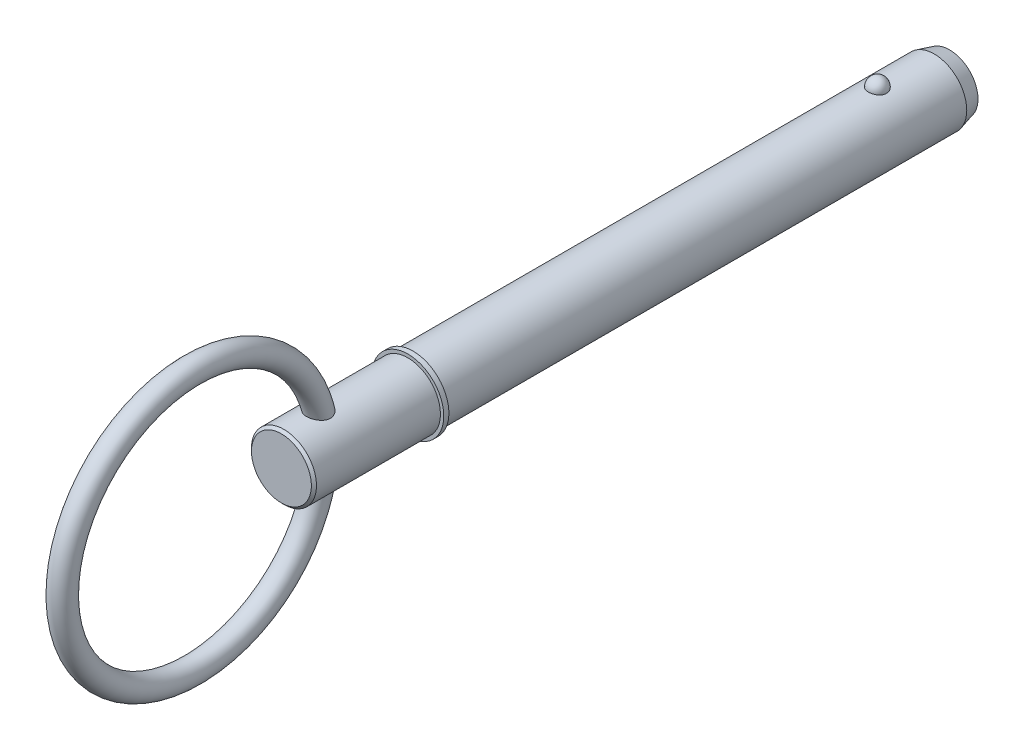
SolidWorks part; units mm, degrees
ref_plane "Front Plane" through (0, 0, 0) normal (0, 0, 1) x (1, 0, 0)
ref_plane "Top Plane" through (0, 0, 0) normal (0, 1, 0) x (1, 0, 0)
ref_plane "Right Plane" through (0, 0, 0) normal (1, 0, 0) x (0, 0, -1)
sketch "Sketch2" plane through (0, 0, 0) normal (0, 0, 1) x (1, 0, 0)
  circle A0 centre (0, 0) radius 6.35
  point P3 (0, 6.35)
  dimension "D1" = 12.7
extrude "Boss-Extrude1" add sketch "Sketch2" along normal blind 88.9
sketch "Sketch3" plane through (0, 0, 0) normal (0, 0, -1) x (-1, 0, 0)
  circle A0 centre (0, 0) radius 6.35
  dimension "D1" = 12.7
extrude "Boss-Extrude2" add sketch "Sketch3" along normal blind 15.88
chamfer "Chamfer1" distance 3 angle 15 1 edges at (-6.35, 0, -15.88)
sketch "Sketch18" plane through (0, 0, 0) normal (1, 0, 0) x (0, 0, -1)
  line L0 (12.88, 6.35) -> (-88.9, 6.35) construction
  line L1 (1.78, 8.13) -> (1.78, 4.57)
  line L2 (-88.9, -6.35) -> (12.88, -6.35) construction
  arc A0 (1.78, 8.13) -> (1.78, 4.57) centre (1.78, 6.35) ccw
  point P4 (0, 6.35)
  dimension "D1" = 14.48
revolve "Revolve1" add sketch "Sketch18" angle 360 about L1
sketch "Sketch19" plane through (0, 0, 0) normal (1, 0, 0) x (0, 0, -1)
  line L0 (-33.7288, 0) -> (-46.4542, 0) construction
sketch "Sketch20" plane through (0, 0, 0) normal (1, 0, 0) x (0, 0, -1)
  line L0 (-88.9, 0) -> (-88.9, 7)
  line L1 (-88.9, 6.35) -> (-88.9, -6.35) construction
  line L2 (-88.9, 7) -> (-89.9, 7)
  line L3 (-89.9, 7) -> (-89.9, 0)
  line L4 (-33.7288, 0) -> (-46.4542, 0) construction
  line L5 (-89.9, 0) -> (-88.9, 0)
  dimension "D1" = 7
  dimension "D2" = 1
revolve "Revolve2" add sketch "Sketch20" angle 360 about L0
sketch "Sketch21" plane through (0, 0, 88.9) normal (0, 0, -1) x (-1, 0, 0)
  circle A0 centre (0, 0) radius 6.35
  dimension "D1" = 12.7
extrude "Boss-Extrude3" add sketch "Sketch21" against normal blind 25.7
chamfer "Chamfer2" distance 0.5 angle 45 1 edges at (-6.35, 0, 114.6)
sketch "Sketch23" plane through (0, 0, 0) normal (1, 0, 0) x (0, 0, -1)
  line L0 (-114.6, 5.85) -> (-114.6, -5.85) construction
  circle A0 centre (-132, 0) radius 25.4
  point P2 (-106.6, 0)
  dimension "D1" = 50.8
  dimension "D2" = 8
sketch "Sketch24" plane through (0, 0, 0) normal (0, 1, 0) x (1, 0, 0)
  circle A0 centre (0, -106.6) radius 2.25
  dimension "D1" = 4.5
sweep "Sweep1" add profiles "Sketch24" path "Sketch23"
